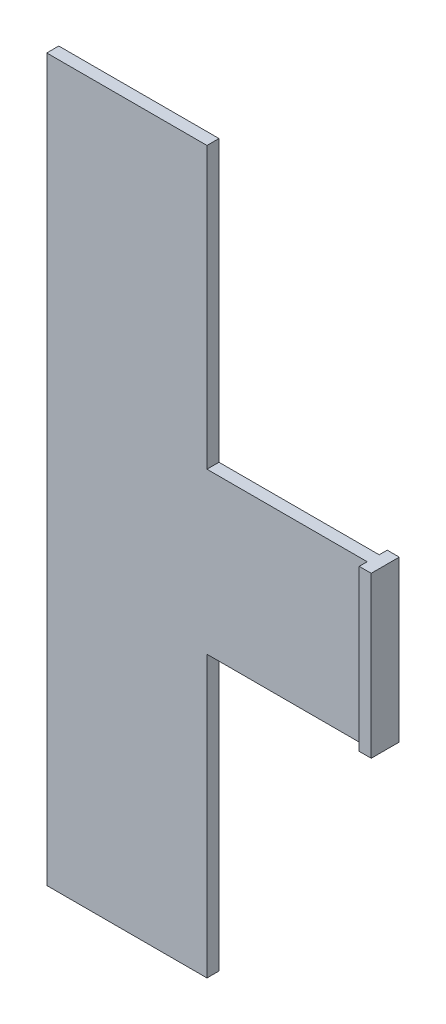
SolidWorks part; units mm, degrees
ref_plane "Front Plane" through (0, 0, 0) normal (0, 0, 1) x (1, 0, 0)
ref_plane "Top Plane" through (0, 0, 0) normal (0, 1, 0) x (1, 0, 0)
ref_plane "Right Plane" through (0, 0, 0) normal (1, 0, 0) x (0, 0, -1)
sketch "Sketch1" plane through (0, 0, 0) normal (0, 1, 0) x (1, 0, 0)
  line L0 (0, 0) -> (0, 3)
  line L1 (0, 3) -> (-40, 3)
  line L2 (-40, 3) -> (-40, 0)
  line L3 (-40, 0) -> (0, 0)
extrude "Boss-Extrude1" add sketch "Sketch1" along normal blind 180
sketch "Sketch2" plane through (0, 0, 0) normal (0, 0, 1) x (1, 0, 0)
  line L0 (-20, 0) -> (-20, 90) construction
  line L1 (-40, 0) -> (0, 0) construction
ref_plane "Plane1" through (0, 90, 0) normal (0, 1, 0) x (1, 0, 0)
sketch "Sketch3" plane through (0, 90, 0) normal (0, 1, 0) x (1, 0, 0)
  line L0 (40, 0) -> (40, -2)
  line L1 (0, 3) -> (40, 3)
  line L2 (0, 3) -> (0, 0)
  line L3 (0, 0) -> (40, 0)
  line L5 (40, 5) -> (43, 5)
  line L6 (40, 5) -> (40, 3)
  line L7 (40, -2) -> (43, -2)
  line L8 (43, 5) -> (43, -2)
extrude "Boss-Extrude2" add sketch "Sketch3" along normal mid plane 40
equation "\"ExternalDiameterBallBearing\" = 22mm"
equation "\"InternalDiameterBallBearing\"= 8mm"
equation "\"WidthJoints\"= 3mm"
equation "\"LenghtJoints\"= 7mm"
equation "\"HeightJoints\"= 40mm"
equation "\"DeepnessJoints\"= 60mm"
equation "\"TurbineShaftDiameter\"= 30mm"
equation "\"HeightTurbine\"= 180mm"
equation "\"HeightBase\"= 20mm"
equation "\"HeightBlade\"= 180mm"
equation "\"HeightBallBearing\"= 7mm"
equation "\"HeightBox\"= 40mm"
equation "\"LenghtBlade\"= 40mm"
equation "\"D1@Sketch1\"=\"LenghtBlade\""
equation "\"D2@Sketch1\"=\"WidthJoints\""
equation "\"D1@Boss-Extrude1\"=\"HeightBlade\""
equation "\"D1@Sketch2\"=\"HeightBlade\"/2"
equation "\"D1@Sketch3\"=\"LenghtBlade\""
equation "\"D2@Sketch3\"=\"WidthJoints\""
equation "\"D3@Sketch3\"=\"LenghtJoints\""
equation "\"D4@Sketch3\"=\"WidthJoints\""
equation "\"D1@Boss-Extrude2\"=\"HeightJoints\""
